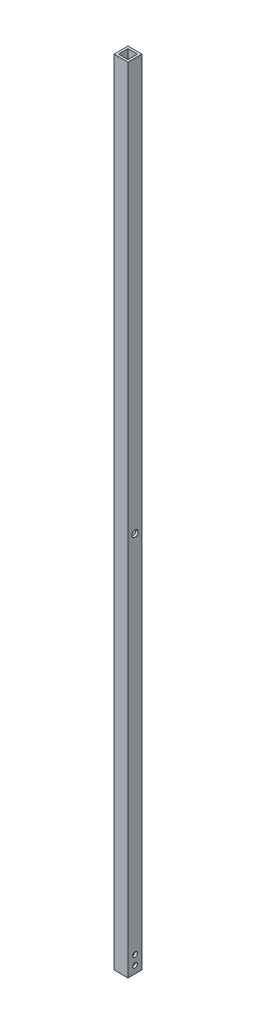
SolidWorks part; units mm, degrees
ref_plane "Front Plane" through (0, 0, 0) normal (0, 0, 1) x (1, 0, 0)
ref_plane "Top Plane" through (0, 0, 0) normal (0, 1, 0) x (1, 0, 0)
ref_plane "Right Plane" through (0, 0, 0) normal (1, 0, 0) x (0, 0, -1)
sketch "Sketch3" plane through (0, 0, 0) normal (0, 1, 0) x (1, 0, 0)
  line L0 (-3.175, -3.175) -> (-3.175, 3.175)
  line L1 (-4.7625, -4.7625) -> (4.7625, -4.7625)
  line L2 (-4.7625, -4.7625) -> (-4.7625, 4.7625)
  line L3 (-4.7625, 4.7625) -> (4.7625, 4.7625)
  line L4 (4.7625, -4.7625) -> (4.7625, 4.7625)
  line L5 (-4.7625, -4.7625) -> (4.7625, 4.7625) construction
  line L6 (-4.7625, 4.7625) -> (4.7625, -4.7625) construction
  line L7 (-3.175, 3.175) -> (3.175, 3.175)
  line L8 (3.175, -3.175) -> (3.175, 3.175)
  line L9 (-3.175, -3.175) -> (3.175, -3.175)
  dimension "D1" = 9.525
  dimension "D2" = 9.525
  dimension "D3" = 1.5875
extrude "Boss-Extrude1" add sketch "Sketch3" along normal blind 538.48
hole_wizard "1/8 (0.125) Diameter Hole1" positions "Sketch5" profile "Sketch4" hole size "1/8" standard "ANSI Inch"
sketch "Sketch5" plane through (-4.7625, 0, 0) normal (-1, 0, 0) x (0, 0, 1)
  circle A0 centre (0, 11.43) radius 1.5875 construction
  circle A1 centre (0, 5.08) radius 1.5875 construction
  point P11 (0, 5.08)
  point P15 (0, 11.43)
sketch "Sketch4" plane through (-4.7625, 5.08, 0) normal (0, 1, 0) x (0, 0, 1)
  line L0 (0, 0) -> (0, 9.525)
  line L1 (0, 9.525) -> (1.5875, 9.525)
  line L2 (1.5875, 9.525) -> (1.5875, 0)
  line L5 (1.5875, 0) -> (0, 0)
  line L11 (0, -6.35) -> (0, 107.95) construction
  dimension "Thru Hole Dia." = 3.175
  dimension "Thru Hole Depth" = 9.525
hole_wizard "#10 (0.1935) Diameter Hole1" positions "Sketch7" profile "Sketch6" hole size "#18" standard "ANSI Inch"
sketch "Sketch7" plane through (-4.7625, 0, 0) normal (-1, 0, 0) x (0, 0, 1)
  line L0 (-4.7625, 258.9212) -> (4.7625, 258.9212) construction
  line L1 (-4.7625, 538.48) -> (-4.7625, 0) construction
  line L2 (4.7625, 538.48) -> (4.7625, 0) construction
  circle A0 centre (0, 258.9212) radius 1.3525 construction
  point P0 (0, 258.9212)
sketch "Sketch6" plane through (-4.7625, 258.9212, 0) normal (0, 1, 0) x (0, 0, 1)
  line L0 (0, 0) -> (0, 9.525)
  line L1 (0, 9.525) -> (2.1526, 9.525)
  line L2 (2.1526, 9.525) -> (2.1526, 0)
  line L5 (2.1526, 0) -> (0, 0)
  line L11 (0, -6.35) -> (0, 107.95) construction
  dimension "Thru Hole Dia." = 4.3053
  dimension "Thru Hole Depth" = 9.525
hole_wizard "1/4 (0.25) Diameter Hole1" positions "Sketch9" profile "Sketch8" hole size "1/4" standard "ANSI Inch"
sketch "Sketch9" plane through (-4.7625, 0, 0) normal (-1, 0, 0) x (0, 0, 1)
  point P0 (0, 258.9212)
sketch "Sketch8" plane through (-4.7625, 258.9212, 0) normal (0, 1, 0) x (0, 0, 1)
  line L0 (0, 0) -> (0, 4.4477)
  line L1 (0, 4.4477) -> (3.175, 2.54)
  line L2 (3.175, 2.54) -> (3.175, 0)
  line L5 (3.175, 0) -> (0, 0)
  line L10 (0, 4.4477) -> (-3.175, 2.54) construction
  line L11 (0, -6.35) -> (0, 107.95) construction
  dimension "Hole Dia." = 6.35
  dimension "Hole Depth" = 2.54
  dimension "Drill Angle" = 118
